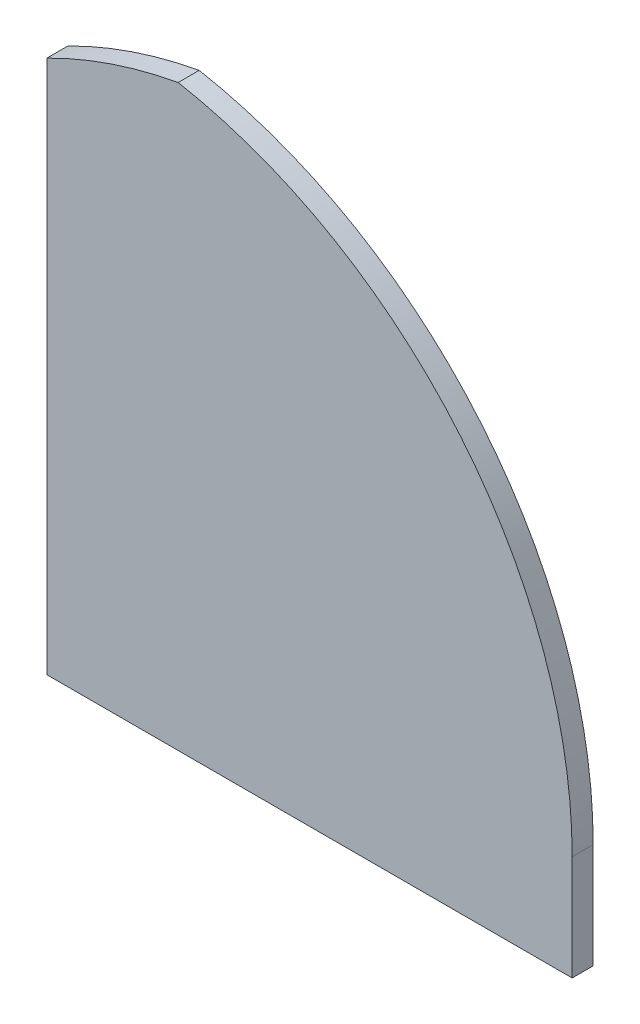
SolidWorks part; units mm, degrees
ref_plane "Alzado" through (0, 0, 0) normal (0, 0, 1) x (1, 0, 0)
ref_plane "Planta" through (0, 0, 0) normal (0, 1, 0) x (1, 0, 0)
ref_plane "Vista lateral" through (0, 0, 0) normal (1, 0, 0) x (0, 0, -1)
sketch "Croquis1" plane through (0, 0, 0) normal (0, 0, 1) x (1, 0, 0)
  line L1 (1518.2986, -491.3706) -> (-481.7014, -491.3706)
  line L2 (-481.7014, -491.3706) -> (-481.7014, 1541.4408)
  line L3 (1518.2986, -491.3706) -> (1518.2986, -91.3706)
  arc A0 (-481.7014, 1541.4408) -> (18.2986, 1711.158) centre (351.3351, -91.3706) cw
  arc A1 (1518.2986, -91.3706) -> (18.2986, 1711.158) centre (-314.7379, -91.3706) ccw
extrude "Saliente-Extruir1" add sketch "Croquis1" along normal blind 80
